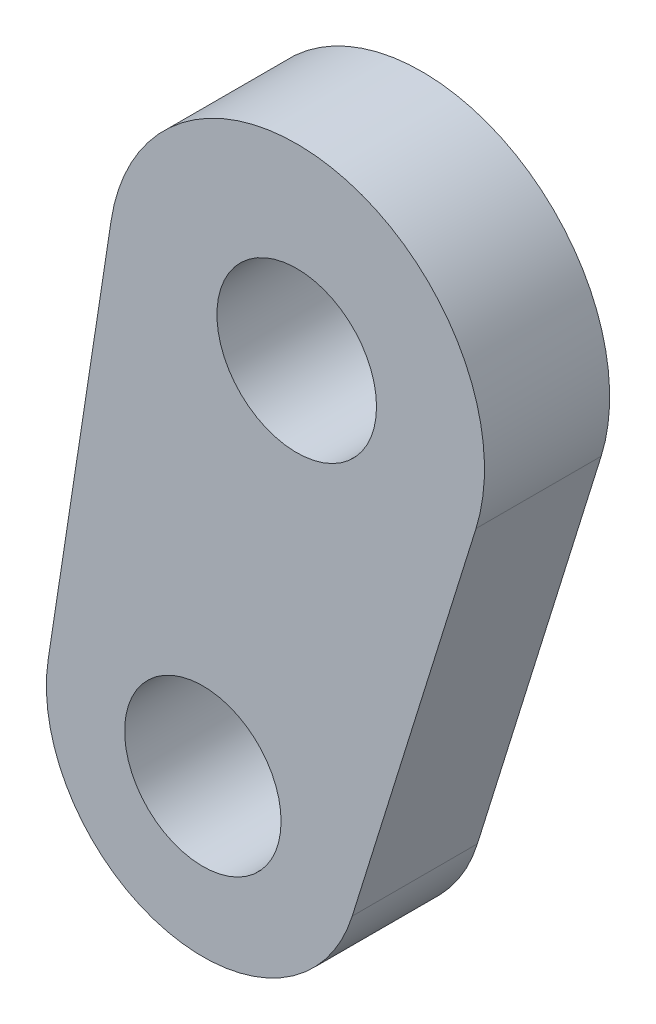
SolidWorks part; units mm, degrees
ref_plane "Alzado" through (0, 0, 0) normal (0, 0, 1) x (1, 0, 0)
ref_plane "Planta" through (0, 0, 0) normal (0, 1, 0) x (1, 0, 0)
ref_plane "Vista lateral" through (0, 0, 0) normal (1, 0, 0) x (0, 0, -1)
ref_plane "Plano1" through (0, 0, 44.4) normal (0, 0, 1) x (1, 0, 0)
sketch "Sk_Patilla" plane through (0, 0, 44.4) normal (0, 0, 1) x (1, 0, 0)
  line L0 (3.548, -28.9726) -> (11.4576, -3.5671)
  line L1 (-11.8621, 1.8143) -> (-15.885, -24.4881)
  arc A0 (11.4576, -3.5671) -> (-11.8621, 1.8143) centre (0, 0) ccw
  arc A1 (-15.885, -24.4881) -> (3.548, -28.9726) centre (-6, -26) ccw
  circle A2 centre (0, 0) radius 5.1
  circle A3 centre (-6, -26) radius 5
extrude "Patilla" add sketch "Sk_Patilla" along normal blind 8
